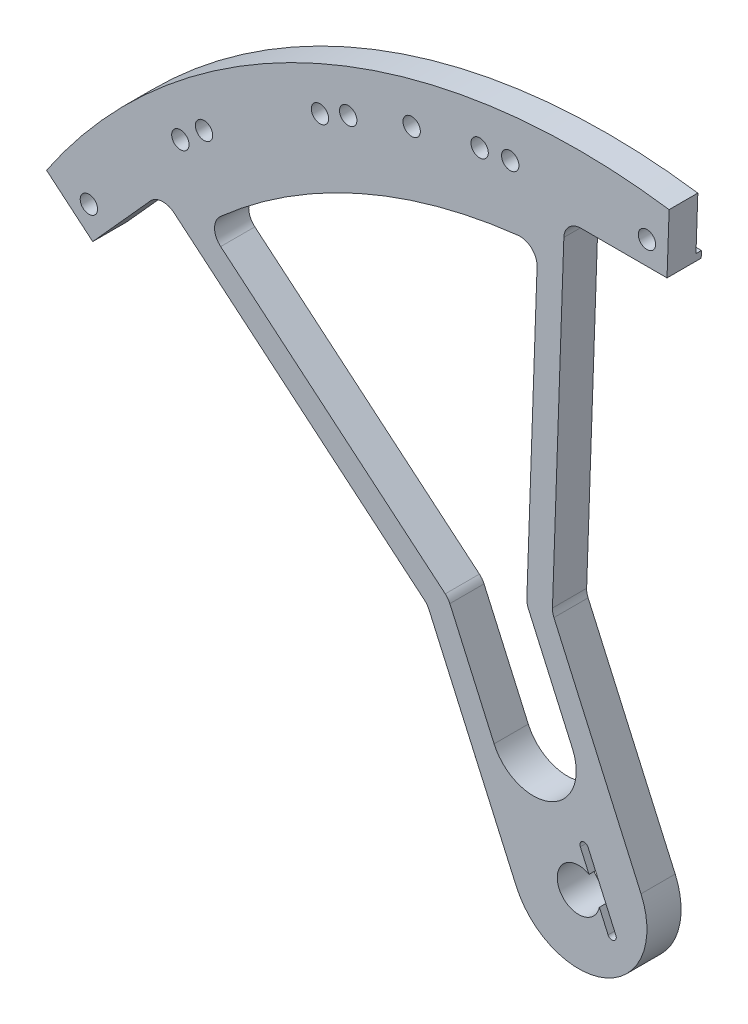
SolidWorks part; units mm, degrees
ref_plane "Front" through (0, 0, 0) normal (0, 0, 1) x (1, 0, 0)
ref_plane "Top" through (0, 0, 0) normal (0, 1, 0) x (1, 0, 0)
ref_plane "Right" through (0, 0, 0) normal (1, 0, 0) x (0, 0, -1)
sketch "Sketch1" plane through (0, 0, 0) normal (0, 0, 1) x (1, 0, 0)
  line L0 (0, -66.675) -> (-11.2678, 13.4996)
  line L1 (0, -66.675) -> (-32.9304, 7.2879)
  line L2 (0, 0) -> (0, -66.675) construction
  line L3 (0, -66.675) -> (-52.0417, -4.6541)
  line L4 (0, -66.675) -> (-67.121, -21.4013)
  line L5 (0, -66.675) -> (11.2678, 13.4996)
  line L6 (0, -66.675) -> (-22.3163, 11.1512) construction
  line L7 (0, -66.675) -> (-42.9036, 1.9851) construction
  line L8 (0, -66.675) -> (-60.1669, -12.5005) construction
  arc A0 (11.2678, 13.4996) -> (-67.121, -21.4013) centre (0, -66.675) ccw
  circle A1 centre (0, -66.675) radius 2.3812
  circle A3 centre (0, 0) radius 74.0918
  dimension "D9" = 4.7625
  dimension "D6" = 148.1836
  dimension "D11" = 161.925
  dimension "D2" = 16
  dimension "D1" = 8
  dimension "D4" = 16
  dimension "D5" = 48
  dimension "D7" = 66.675
  dimension "D8" = 16
  dimension "D10" = 16
  dimension "D12" = 16
  dimension "D13" = 16
  dimension "D14" = 16
  dimension "D3" = 4
sketch "Sketch2" plane through (0, 0, 0) normal (0, 0, 1) x (1, 0, 0)
  line L0 (-4.0817, -71.5394) -> (-49.4251, -33.4917)
  line L3 (0, -66.675) -> (-32.9304, 7.2879) construction
  line L4 (8.4119, -7.7411) -> (6.3461, -66.8966)
  arc A0 (8.4119, -7.7411) -> (-49.4251, -33.4917) centre (0, -66.675) ccw
  arc A1 (-4.0817, -71.5394) -> (6.3461, -66.8966) centre (0, -66.675) ccw
  circle A2 centre (0, -66.675) radius 1.9812
  dimension "D1" = 12.7
  dimension "D2" = 119.0625
  dimension "D3" = 3.9624
  dimension "D4" = 26
  dimension "D5" = 26
extrude "Boss-Extrude1" add sketch "Sketch2" against normal blind 3.175
sketch "Sketch3" plane through (0, 0, -3.175) normal (0, 0, -1) x (-1, 0, 0)
  line L2 (4.0817, -71.5394) -> (49.4251, -33.4917)
  line L3 (-8.4119, -7.7411) -> (-6.3461, -66.8966)
  line L4 (4.0817, -71.5394) -> (49.4251, -33.4917)
  line L5 (-8.4119, -7.7411) -> (-6.3461, -66.8966)
  line L8 (7.5857, -12.7) -> (-8.2387, -12.7)
  line L9 (22.1694, -16.8818) -> (7.5857, -12.7)
  line L10 (35.0354, -24.9214) -> (22.1694, -16.8818)
  line L11 (45.624, -36.6812) -> (35.0354, -24.9214)
  line L12 (-5.6944, -10.5204) -> (-9.0111, -13.8371) construction
  line L13 (5.6944, -10.5204) -> (9.0111, -13.8371) construction
  line L14 (10.0044, -11.1262) -> (7.9779, -12.2495) construction
  line L15 (20.9521, -14.2654) -> (23.6529, -19.1377) construction
  line L16 (24.9282, -16.0356) -> (23.0314, -16.4736) construction
  line L17 (34.5865, -22.0708) -> (36.1918, -29.024) construction
  line L18 (37.9206, -24.8685) -> (37.1482, -24.828) construction
  line L19 (45.5413, -33.3321) -> (45.1054, -41.6495) construction
  line L21 (28.6024, -20.9016) -> (0, -66.675) construction
  line L22 (-5.4229, -12.7) -> (-5.4229, -11.176) construction
  line L23 (-6.35, -10.2489) -> (-7.537, -10.2489) construction
  line L24 (-5.4229, -12.7) -> (-5.4229, -11.176)
  line L25 (-6.35, -10.2489) -> (-7.537, -10.2489)
  line L26 (5.4229, -11.176) -> (5.4229, -12.7) construction
  line L27 (7.537, -10.2489) -> (6.35, -10.2489) construction
  line L28 (5.4229, -11.176) -> (5.4229, -12.7)
  line L29 (7.537, -10.2489) -> (6.35, -10.2489)
  line L30 (40.1112, -30.5587) -> (0, -66.675) construction
  line L31 (14.8775, -14.7909) -> (0, -66.675) construction
  arc A0 (37.6152, -25.5089) -> (37.6838, -24.1996) centre (36.9948, -24.8199) ccw construction
  arc A1 (46.1817, -33.6375) -> (44.8724, -33.5689) centre (45.4928, -34.2579) ccw construction
  arc A2 (-6.3461, -66.8966) -> (4.0817, -71.5394) centre (0, -66.675) ccw
  arc A3 (49.4251, -33.4917) -> (-8.4119, -7.7411) centre (0, -66.675) ccw
  arc A4 (-6.3461, -66.8966) -> (4.0817, -71.5394) centre (0, -66.675) ccw
  arc A5 (49.4251, -33.4917) -> (-8.4119, -7.7411) centre (0, -66.675) ccw
  arc A6 (35.2864, -22.1879) -> (34.0089, -22.4829) centre (34.7951, -22.9742) ccw construction
  arc A7 (24.8111, -16.7355) -> (24.5162, -15.458) centre (24.0249, -16.2442) ccw construction
  arc A8 (21.6571, -14.185) -> (20.5104, -14.8207) centre (21.4016, -15.0762) ccw construction
  arc A9 (10.0848, -11.8312) -> (9.4491, -10.6845) centre (9.1936, -11.5756) ccw construction
  arc A10 (6.35, -10.2489) -> (5.4229, -11.176) centre (6.35, -11.176) ccw construction
  arc A11 (-5.4229, -11.176) -> (-6.35, -10.2489) centre (-6.35, -11.176) ccw construction
  arc A12 (37.6152, -25.5089) -> (37.6838, -24.1996) centre (36.9948, -24.8199) ccw
  arc A13 (46.1817, -33.6375) -> (44.8724, -33.5689) centre (45.4928, -34.2579) ccw
  arc A14 (35.2864, -22.1879) -> (34.0089, -22.4829) centre (34.7951, -22.9742) ccw
  arc A15 (24.8111, -16.7355) -> (24.5162, -15.458) centre (24.0249, -16.2442) ccw
  arc A16 (21.6571, -14.185) -> (20.5104, -14.8207) centre (21.4016, -15.0762) ccw
  arc A17 (10.0848, -11.8312) -> (9.4491, -10.6845) centre (9.1936, -11.5756) ccw
  arc A18 (6.35, -10.2489) -> (5.4229, -11.176) centre (6.35, -11.176) ccw
  arc A19 (-5.4229, -11.176) -> (-6.35, -10.2489) centre (-6.35, -11.176) ccw
  circle A20 centre (0, -66.675) radius 53.975
  circle A22 centre (6.35, -11.176) radius 0.762
  circle A23 centre (6.35, -11.176) radius 1.2192
  dimension "D2" = 107.95
  dimension "D4" = 2.4384
  dimension "D5" = 1.524
  dimension "D1" = 0
sketch "Sketch4" plane through (0, 0, -3.175) normal (0, 0, -1) x (-1, 0, 0)
  line L0 (45.624, -36.6812) -> (35.0354, -24.9214) construction
  line L1 (35.0354, -24.9214) -> (22.1694, -16.8818) construction
  line L2 (22.1694, -16.8818) -> (7.5857, -12.7) construction
  line L3 (7.5857, -12.7) -> (-8.2387, -12.7) construction
  line L4 (45.624, -36.6812) -> (35.0354, -24.9214)
  line L5 (35.0354, -24.9214) -> (22.1694, -16.8818)
  line L6 (22.1694, -16.8818) -> (7.5857, -12.7)
  line L7 (7.5857, -12.7) -> (-8.2387, -12.7)
  line L8 (4.0817, -71.5394) -> (49.4251, -33.4917) construction
  line L9 (-8.4119, -7.7411) -> (-6.3461, -66.8966) construction
  line L10 (45.624, -36.6812) -> (49.4251, -33.4917)
  line L11 (-8.4119, -7.7411) -> (-8.2387, -12.7)
  arc A0 (49.4251, -33.4917) -> (-8.4119, -7.7411) centre (0, -66.675) ccw construction
  arc A1 (49.4251, -33.4917) -> (-8.4119, -7.7411) centre (0, -66.675) ccw
extrude "Cut-Extrude1" cut sketch "Sketch4" against normal blind 0.508
sketch "Sketch8" plane through (0, 0, 0) normal (0, 0, 1) x (1, 0, 0)
  line L0 (-1.448, -68.0272) -> (1.448, -68.0272)
  line L1 (1.7749, -67.9764) -> (-1.7749, -67.9764) construction
  circle A2 centre (0, -66.675) radius 1.9812 construction
  arc A3 (-1.448, -68.0272) -> (1.448, -68.0272) centre (0, -66.675) ccw
  dimension "D1" = 0.0508
extrude "Boss-Extrude2" [suppressed] add sketch "Sketch8" against normal up to surface (3.175 mm away)
sketch "Sketch9" plane through (0, 0, -3.175) normal (0, 0, -1) x (-1, 0, 0)
  line L1 (7.5857, -12.7) -> (22.1694, -16.8818) construction
  line L4 (0, -66.675) -> (0, -12.7) construction
  line L5 (28.6024, -20.9016) -> (0, -66.675) construction
  line L6 (14.8775, -14.7909) -> (0, -66.675) construction
  line L7 (40.1112, -30.5587) -> (0, -66.675) construction
  line L9 (35.0354, -24.9214) -> (45.624, -36.6812) construction
  line L10 (-8.2387, -12.7) -> (7.5857, -12.7) construction
  line L11 (-8.2387, -12.7) -> (7.5857, -12.7) construction
  line L12 (7.5857, -12.7) -> (22.1694, -16.8818) construction
  line L13 (22.1694, -16.8818) -> (35.0354, -24.9214) construction
  line L14 (35.0354, -24.9214) -> (45.624, -36.6812) construction
  line L15 (0, -12.7) -> (7.5857, -12.7)
  line L16 (7.5857, -12.7) -> (14.8775, -14.7909)
  line L17 (28.6024, -20.9016) -> (35.0354, -24.9214)
  line L18 (35.0354, -24.9214) -> (40.1112, -30.5587)
  point P0 (0, -66.675)
  point P3 (14.8775, -14.7909)
  dimension "D1" = 16
  dimension "D2" = 16
  dimension "D3" = 16
hole_wizard "#52 (0.0635) Diameter Hole1" positions "Sketch6" profile "Sketch7" hole size "#52" standard "Ansi Inch"
sketch "Sketch6" plane through (0, 0, -2.667) normal (0, 0, -1) x (-1, 0, 0)
  point P0 (9.1936, -11.5756)
  point P1 (-6.35, -11.176)
  point P4 (6.35, -11.176)
  point P7 (21.4016, -15.0762)
  point P10 (24.0249, -16.2442)
  point P13 (34.7951, -22.9742)
  point P16 (36.9948, -24.8199)
  point P19 (45.4928, -34.2579)
  point P25 (15.5054, -13.0081)
sketch "Sketch7" plane through (-9.1936, -11.5756, -2.667) normal (1, 0, 0) x (0, 1, 0)
  line L0 (0, 0) -> (0, 2.667)
  line L1 (0, 2.667) -> (0.8064, 2.667)
  line L2 (0.8064, 2.667) -> (0.8064, 0)
  line L5 (0.8064, 0) -> (0, 0)
  line L11 (0, -6.35) -> (0, 107.95) construction
  dimension "Thru Hole Dia." = 1.6129
  dimension "Thru Hole Depth" = 2.667
ref_plane "Plane1" through (0, -12.7, -3.175) normal (-1, 0, 0) x (0, 0, 1)
ref_plane "Plane2" through (-14.8775, -14.7909, -3.175) normal (-0.9613, -0.2756, 0) x (0, 0, 1)
ref_plane "Plane3" through (-28.6024, -20.9016, -3.175) normal (-0.848, -0.5299, 0) x (0, 0, 1)
ref_plane "Plane4" through (-40.1112, -30.5587, -3.175) normal (-0.6691, -0.7431, 0) x (0.7431, -0.6691, 0)
sketch "Sketch13" plane through (0, 0, -3.175) normal (0, 0, -1) x (-1, 0, 0)
  circle A2 centre (20.4045, -77.6276) radius 1.5
  circle A3 centre (42.8431, -90.1796) radius 1.5
  circle A4 centre (-1.4924, -17.8307) radius 1.5 construction
  circle A5 centre (-0.4954, -43.522) radius 1.5 construction
  circle A6 centre (-1.4924, -17.8307) radius 1.5
  circle A7 centre (-0.4954, -43.522) radius 1.5
sketch "Sketch14" plane through (0, 0, -3.175) normal (0, 0, -1) x (-1, 0, 0)
  line L0 (-8.2165, -13.335) -> (-6.3461, -66.8966)
  line L2 (14.3231, -50.5118) -> (37.5856, -30.9923)
  line L3 (39.7857, -31.1462) -> (45.1373, -37.0897)
  line L4 (45.624, -36.6812) -> (4.0817, -71.5394) construction
  line L5 (35.0354, -24.9214) -> (45.624, -36.6812) construction
  line L6 (33.2509, -31.5459) -> (12.387, -49.0528)
  line L7 (45.1373, -37.0897) -> (4.0817, -71.5394)
  line L8 (0, -66.675) -> (24.2135, -12.2905) construction
  line L9 (2.2913, -45.9166) -> (-5.801, -64.0922)
  line L10 (-0.2188, -13.335) -> (-8.2165, -13.335)
  line L11 (4.6711, -46.3792) -> (0.5617, -55.609)
  line L12 (13.8933, -51.0822) -> (5.801, -69.2578)
  line L13 (11.9571, -49.6232) -> (7.8478, -58.8529)
  line L14 (11.308, -51.0813) -> (4.9852, -65.2824) construction
  line L15 (13.4659, -52.0421) -> (7.1432, -66.2432) construction
  line L16 (2.4276, -45.2155) -> (1.3678, -14.8671)
  line L17 (3.8568, -18.4588) -> (4.8073, -45.6781)
  arc A0 (4.0817, -71.5394) -> (5.801, -69.2578) centre (0, -66.675) ccw
  arc A1 (33.2837, -29.1421) -> (5.6213, -16.8259) centre (0, -66.675) ccw
  arc A2 (12.387, -49.0528) -> (11.9571, -49.6232) centre (13.4074, -50.2689) ccw
  arc A3 (37.5856, -30.9923) -> (39.7857, -31.1462) centre (38.606, -32.2084) cw
  arc A4 (33.2509, -31.5459) -> (33.2837, -29.1421) centre (32.2304, -30.3298) ccw
  arc A6 (0.5617, -55.609) -> (7.8478, -58.8529) centre (4.2048, -57.2309) ccw
  arc A7 (14.3231, -50.5118) -> (13.8933, -51.0822) centre (15.3436, -51.7279) ccw
  arc A8 (4.8073, -45.6781) -> (4.6711, -46.3792) centre (3.2208, -45.7335) cw
  arc A9 (49.4251, -33.4917) -> (-8.4119, -7.7411) centre (0, -66.675) ccw construction
  arc A10 (3.8568, -18.4588) -> (5.6213, -16.8259) centre (5.4434, -18.4034) cw
  arc A11 (1.3678, -14.8671) -> (-0.2188, -13.335) centre (-0.2188, -14.9225) ccw
  arc A12 (-6.3461, -66.8966) -> (-5.801, -64.0922) centre (0, -66.675) cw
  arc A13 (2.4276, -45.2155) -> (2.2913, -45.9166) centre (0.841, -45.2709) cw
  dimension "D5" = 50.165
  dimension "D6" = 1.5875
  dimension "D2" = 9.525
  dimension "D3" = 0.635
  dimension "D4" = 2.3622
  dimension "D8" = 2.3622
extrude "Cut-Extrude2" cut sketch "Sketch14" against normal through all
sketch "Sketch15" plane through (0, 0, 0) normal (0, 0, 1) x (1, 0, 0)
  line L0 (0.522, -62.9671) -> (3.1048, -68.7681) construction
  line L1 (0.884, -62.806) -> (3.4668, -68.607)
  line L2 (0.16, -63.1283) -> (2.7428, -68.9293)
  line L3 (5.801, -64.0922) -> (-2.2913, -45.9166) construction
  line L4 (0.522, -62.9671) -> (-1.7136, -63.9625) construction
  arc A0 (0.884, -62.806) -> (0.16, -63.1283) centre (0.522, -62.9671) ccw
  arc A1 (2.7428, -68.9293) -> (3.4668, -68.607) centre (3.1048, -68.7681) ccw
  circle A2 centre (0, -66.675) radius 1.9812 construction
  point P2 (1.8134, -65.8676)
  dimension "D1" = 1.985
  dimension "D4" = 3.175
  dimension "D2" = 0.7925
  dimension "D3" = 6.35
extrude "Cut-Extrude3" cut sketch "Sketch15" against normal blind 0.7925
ref_plane "Plane5" through (24.7746, -55.6446, 0) normal (-0.4067, 0.9135, 0) x (-0.9135, -0.4067, 0)
sketch "Sketch16" plane through (0, 0, 0) normal (0, 0, 1) x (1, 0, 0)
  line L0 (-38.9529, -18.8529) -> (-9.4742, -5.7281)
  line L2 (-24.2135, -12.2905) -> (2.5828, -72.476)
  line L3 (2.5828, -72.476) -> (-9.3301, -77.78)
  arc A0 (8.4119, -7.7411) -> (-49.4251, -33.4917) centre (0, -66.675) ccw construction
  arc A1 (-5.801, -69.2578) -> (5.801, -64.0922) centre (0, -66.675) ccw construction
equation "\"D8@Sketch14\" = \"D4@Sketch14\""
